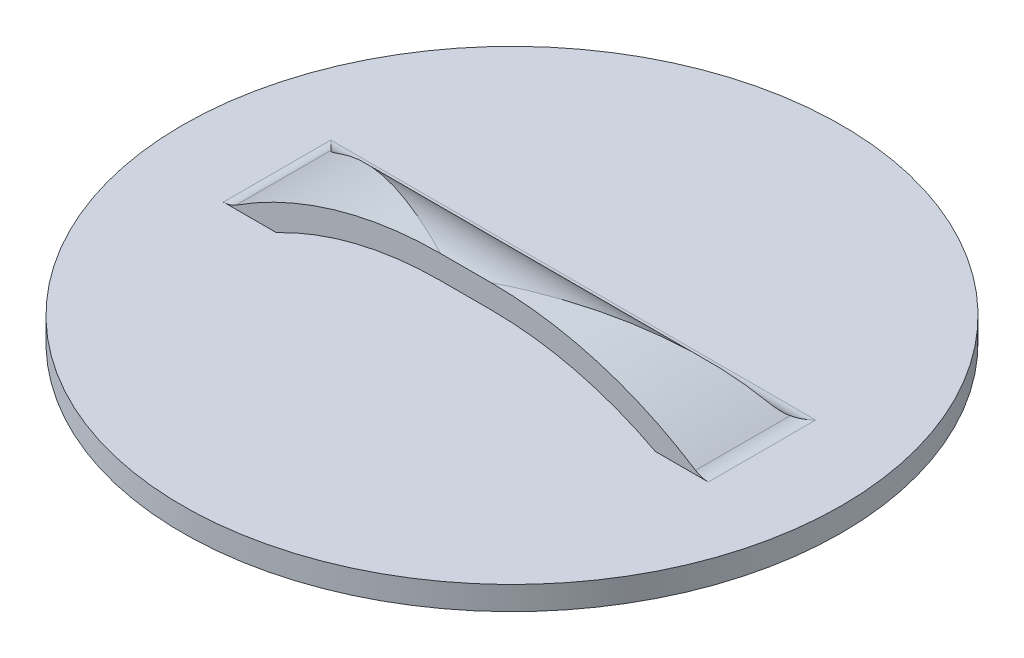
SolidWorks part; units mm, degrees
ref_plane "Front Plane" through (0, 0, 0) normal (0, 0, 1) x (1, 0, 0)
ref_plane "Top Plane" through (0, 0, 0) normal (0, 1, 0) x (1, 0, 0)
ref_plane "Right Plane" through (0, 0, 0) normal (1, 0, 0) x (0, 0, -1)
sketch "Sketch1" plane through (0, 0, 0) normal (0, 0, 1) x (1, 0, 0)
  line L0 (-44.45, 0) -> (44.45, 0)
  line L1 (0, 0) -> (0, -21.6641) construction
  line L2 (-44.45, 3.175) -> (-31.75, 3.175)
  line L3 (-44.45, 3.175) -> (-44.45, 0)
  line L4 (44.45, 3.175) -> (44.45, 0)
  line L5 (-3.4163, 11.811) -> (3.4163, 11.811)
  line L6 (-31.75, 3.175) -> (-31.75, -17.5977) construction
  line L7 (31.75, 3.175) -> (31.75, -20.4021) construction
  line L8 (-3.4163, 8.636) -> (3.4163, 8.636)
  line L9 (-25.5593, 3.175) -> (25.5593, 3.175)
  line L10 (31.75, 3.175) -> (44.45, 3.175)
  line L11 (-44.45, 3.175) -> (44.45, 3.175) construction
  arc A0 (-3.4163, 11.811) -> (-31.75, 3.175) centre (-3.4163, -38.9868) ccw
  arc A1 (3.4163, 11.811) -> (31.75, 3.175) centre (3.4163, -38.9868) cw
  arc A2 (-3.4163, 8.636) -> (-25.5593, 3.175) centre (-3.4163, -38.9868) ccw
  arc A3 (3.4163, 8.636) -> (25.5593, 3.175) centre (3.4163, -38.9868) cw
  arc A5 (-3.4163, 8.636) -> (-29.9791, 0.5398) centre (-3.4163, -38.9868) ccw construction
  arc A6 (3.4163, 8.636) -> (29.9791, 0.5398) centre (3.4163, -38.9868) cw construction
  dimension "D1" = 88.9
  dimension "D3" = 6.8326
  dimension "D4" = 63.5
  dimension "D5" = 8.636
  dimension "D2" = 3.175
  dimension "D6" = 3.175
extrude "Boss-Extrude1" add sketch "Sketch1" along normal blind 12.7
sketch "Sketch2" plane through (-44.45, 0, 0) normal (-1, 0, 0) x (0, 0, 1)
  line L0 (0.254, 3.175) -> (0.254, 5.2187) construction
  line L1 (12.7, 3.175) -> (0, 3.175) construction
  line L2 (12.7, 3.175) -> (12.7, 11.811) construction
  line L4 (0.254, 3.175) -> (0, 3.175)
  line L5 (0, 3.175) -> (0, 11.811)
  line L6 (0, 11.811) -> (12.7, 11.811)
  arc A2 (12.7, 11.811) -> (0.254, 3.175) centre (12.7, -1.4754) ccw
  dimension "D1" = 12.446
extrude "Cut-Extrude1" cut sketch "Sketch2" against normal through all
sketch "Sketch4" plane through (0, 0, 12.7) normal (0, 0, 1) x (1, 0, 0)
  line L1 (-25.5593, 3.175) -> (25.5593, 3.175)
  line L2 (-25.5593, 3.175) -> (-25.5593, -4.4864)
  line L3 (-25.5593, -4.4864) -> (25.5593, -4.4864)
  line L4 (25.5593, 3.175) -> (25.5593, -4.4864)
  point P5 (25.5593, 3.175)
extrude "Cut-Extrude2" cut sketch "Sketch4" against normal through all
other "DeleteFace1"
other "DeleteFace2"
sketch "Sketch5" plane through (0, 3.175, 0) normal (0, 1, 0) x (1, 0, 0)
  line L0 (44.45, -12.7) -> (44.45, 0) construction
  line L1 (-44.45, 0) -> (44.45, 0)
  line L2 (-44.45, 0) -> (-44.45, -0.254)
  line L3 (-44.45, -0.254) -> (44.45, -0.254)
  line L4 (44.45, 0) -> (44.45, -0.254)
  line L5 (31.75, -0.254) -> (25.5593, -0.254) construction
extrude "Cut-Extrude3" cut sketch "Sketch5" against normal through all
sketch "Sketch6" plane through (0, 0, 0) normal (1, 0, 0) x (0, 0, -1)
  line L0 (-12.7, 11.811) -> (-12.7, 8.636)
  line L1 (-3.7214, 3.175) -> (-0.254, 3.175)
  line L4 (-9.525, 8.1246) -> (-9.525, 6.35) construction
  line L5 (-9.525, 6.35) -> (-6.2966, 6.35) construction
  line L7 (-12.7, 11.811) -> (-12.7, 3.175) construction
  line L8 (-12.7, 3.175) -> (-0.254, 3.175) construction
  arc A0 (-0.254, 3.175) -> (-12.7, 11.811) centre (-12.7, -1.4754) ccw construction
  arc A1 (-0.254, 3.175) -> (-12.7, 11.811) centre (-12.7, -1.4754) ccw
  arc A2 (-3.7214, 3.175) -> (-12.7, 8.636) centre (-12.7, -1.4754) ccw
  arc A3 (-6.2966, 6.35) -> (-9.525, 8.1246) centre (-12.7, -1.4754) ccw construction
  dimension "D1" = 3.175
extrude "Boss-Extrude2" add sketch "Sketch6" along normal up to vertex and the other way up to vertex
other "DeleteFace4"
other "Move Face1" parameters "D1"=3.175
sketch "Sketch8" plane through (0, 0, 0) normal (0, -1, 0) x (-1, 0, 0)
  line L0 (-44.45, -6.477) -> (44.45, -6.477) construction
  line L1 (-44.45, -12.7) -> (-44.45, -0.254) construction
  line L2 (44.45, -12.7) -> (44.45, -0.254) construction
  circle A0 centre (0, -6.477) radius 44.45
  point P8 (0, -6.477)
  point P9 (0, 0)
  point P10 (0, -6.477)
  dimension "D1" = 88.9
extrude "Boss-Extrude3" add sketch "Sketch8" against normal up to vertex
other "DeleteFace7"
fillet "Fillet2" radius 3.175 3 edges at (-31.75, 3.175, 6.477) (0, 3.175, 0.254) (31.75, 3.175, 6.477)
